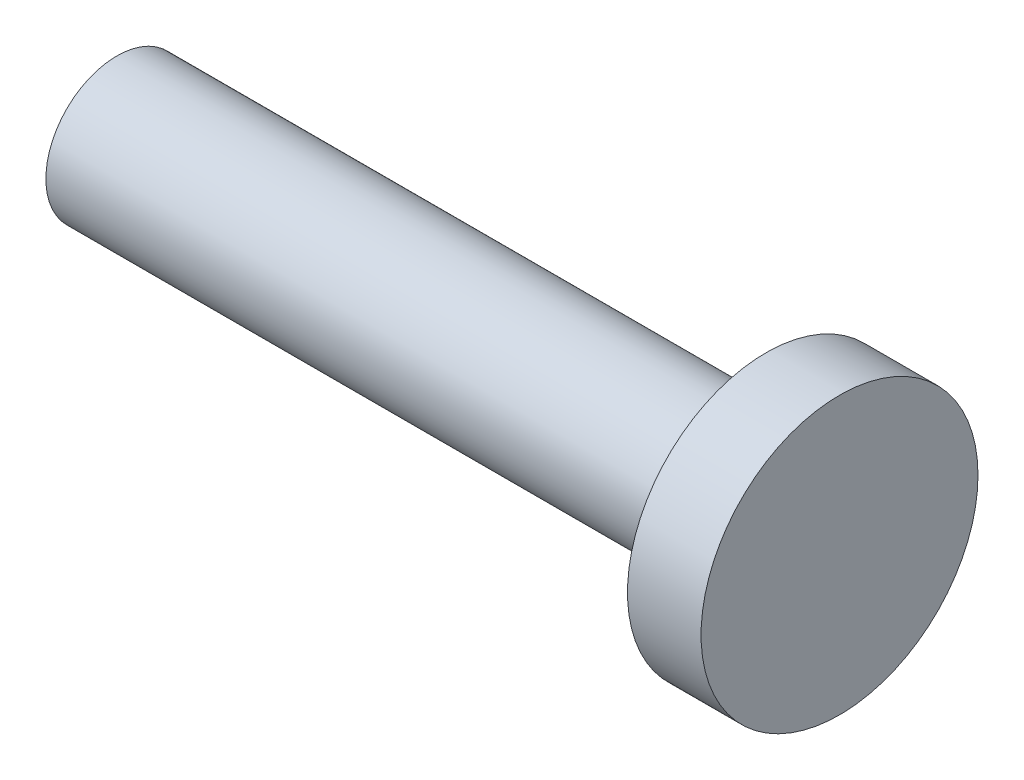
SolidWorks part; units mm, degrees
ref_plane "Front Plane" through (0, 0, 0) normal (1, 0, 0) x (0, 1, 0)
ref_plane "Top Plane" through (0, 0, 0) normal (0, 0, 1) x (0, 1, 0)
ref_plane "Right Plane" through (0, 0, 0) normal (0, 1, 0) x (-1, 0, 0)
sketch "Sketch1" plane through (0, 0, 0) normal (1, 0, 0) x (0, 1, 0)
  circle A0 centre (0, 0) radius 2.085
extrude "Circular_section" add sketch "Sketch1" along normal blind 19.05
ref_plane "Plane1" through (19.05, 0, 0) normal (1, 0, 0) x (0, 1, 0)
sketch "Sketch2" plane through (19.05, 0, 0) normal (1, 0, 0) x (0, 1, 0)
  circle A0 centre (0, 0) radius 4.064
extrude "Boss-Extrude2" add sketch "Sketch2" along normal blind 2.159
